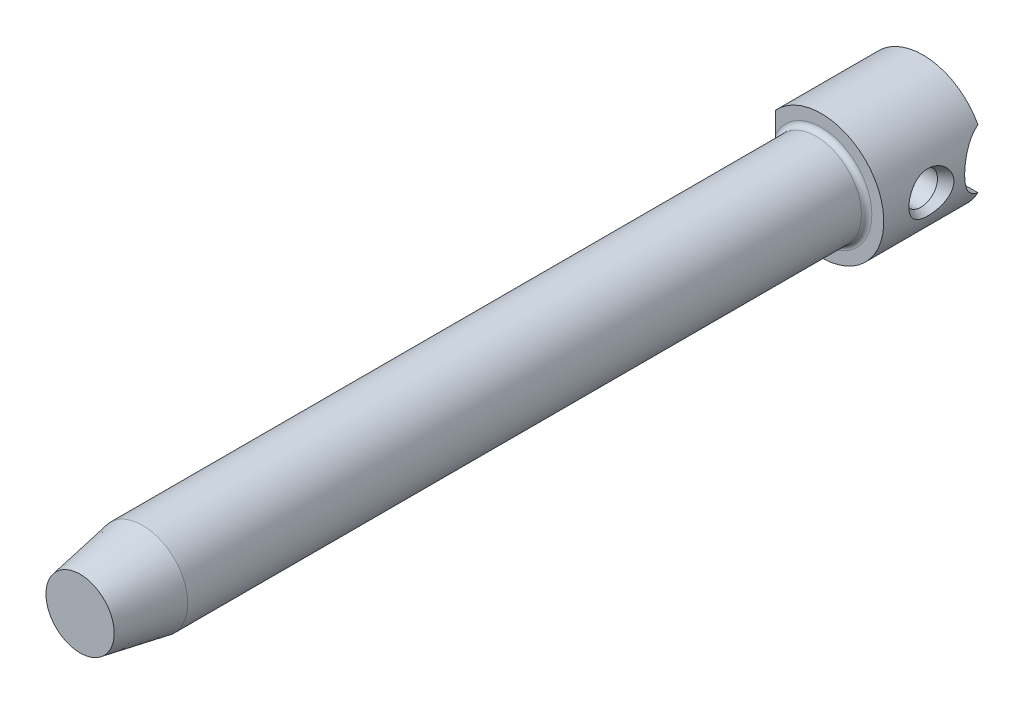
SolidWorks part; units mm, degrees
ref_plane "Спереди" through (0, 0, 0) normal (0, 0, 1) x (1, 0, 0)
ref_plane "Сверху" through (0, 0, 0) normal (0, 1, 0) x (1, 0, 0)
ref_plane "Справа" through (0, 0, 0) normal (1, 0, 0) x (0, 0, -1)
sketch "Эскиз1" plane through (0, 0, 0) normal (1, 0, 0) x (0, 0, -1)
  line L0 (-60.1789, 0) -> (58.9386, 0) construction
  line L1 (-60.1789, 0) -> (-60.1789, 2.6035)
  line L2 (-60.1789, 2.6035) -> (-55.4164, 3.4544)
  line L3 (-55.4164, 3.4544) -> (-4.0291, 3.4544)
  line L4 (-3.6322, 3.8513) -> (-3.6322, 4.7625)
  line L5 (-3.6322, 4.7625) -> (4.1148, 4.7625)
  line L6 (4.1148, 4.7625) -> (4.1148, 0)
  line L7 (4.1148, 0) -> (-60.1789, 0)
  arc A0 (-4.0291, 3.4544) -> (-3.6322, 3.8513) centre (-4.0291, 3.8513) ccw
  dimension "D8" = 0.3969
  dimension "D1" = 5.207
  dimension "D2" = 6.9088
  dimension "D3" = 9.525
  dimension "D4" = 4.7625
  dimension "D5" = 7.747
  dimension "D6" = 64.2938
  dimension "D7" = 4.1148
revolve "Повернуть1" add sketch "Эскиз1" angle 360 about L0
sketch "Эскиз2" plane through (0, 0, -4.1148) normal (0, 0, -1) x (-1, 0, 0)
  line L0 (3.4798, 3.2515) -> (3.4798, -3.2515)
  circle A0 centre (0, 0) radius 4.7625 construction
  arc A1 (3.4798, -3.2515) -> (3.4798, 3.2515) centre (0, 0) ccw
  dimension "D1" = 3.4798
extrude "Вырез-Вытянуть1" cut sketch "Эскиз2" against normal through all
sketch "Эскиз3" plane through (-3.4798, 0, 0) normal (-1, 0, 0) x (0, 0, 1)
  line L0 (-4.1148, 2.2405) -> (-4.1148, -2.2405)
  line L1 (-4.1148, 3.2515) -> (-4.1148, -3.2515) construction
  line L2 (0, 0) -> (-2.54, 0) construction
  line L4 (3.6322, -4.7625) -> (3.6322, 4.7625) construction
  arc A0 (-4.1148, -2.2405) -> (-4.1148, 2.2405) centre (-4.9212, 0) ccw
  dimension "D2" = 2.3813
  dimension "D1" = 6.1722
extrude "Вырез-Вытянуть2" cut sketch "Эскиз3" against normal through all
sketch "Эскиз4" plane through (0, 0, 0) normal (0, 1, 0) x (1, 0, 0)
  line L0 (-4.441, 0) -> (6.5196, 0) construction
  line L1 (-3.4798, -1.7156) -> (-3.4798, 0)
  line L2 (-3.4798, 0) -> (4.7625, 0)
  line L3 (4.7625, 0) -> (4.7625, -1.7156)
  line L4 (4.7625, -3.6322) -> (4.7625, 2.54) construction
  line L5 (4.7625, -1.7156) -> (3.9688, -1.2573)
  line L6 (3.9688, -1.2573) -> (-2.6861, -1.2573)
  line L7 (-2.6861, -1.2573) -> (-3.4798, -1.7156)
  line L8 (-3.4798, -3.6322) -> (-3.4798, 4.1148) construction
  dimension "D1" = 30
  dimension "D2" = 30
  dimension "D3" = 2.5146
  dimension "D4" = 0.7937
  dimension "D5" = 0.7937
revolve "Вырез-Повернуть1" cut sketch "Эскиз4" angle 360 about L0
